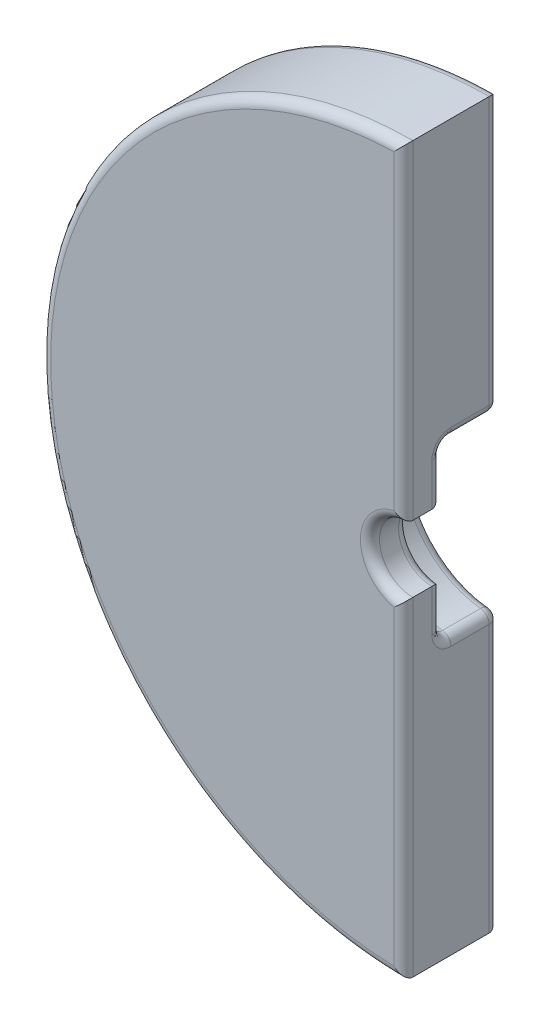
SolidWorks part; units mm, degrees
ref_plane "Спереди" through (0, 0, 0) normal (0, 0, 1) x (1, 0, 0)
ref_plane "Сверху" through (0, 0, 0) normal (0, 1, 0) x (1, 0, 0)
ref_plane "Справа" through (0, 0, 0) normal (1, 0, 0) x (0, 0, -1)
sketch "Эскиз1" plane through (0, 0, 0) normal (0, 0, 1) x (1, 0, 0)
  line L0 (0, 19) -> (0, 1.75)
  line L1 (0, -1.75) -> (0, -19)
  arc A0 (0, 19) -> (0, -19) centre (0, 0) ccw
  arc A1 (0, 1.75) -> (0, -1.75) centre (0, 0) ccw
  dimension "D1" = 38
  dimension "D2" = 3.5
extrude "Бобышка-Вытянуть1" add sketch "Эскиз1" along normal mid plane 5
sketch "Эскиз2" plane through (0, 0, -2.5) normal (0, 0, -1) x (-1, 0, 0)
  circle A0 centre (0, 0) radius 4.5
  dimension "D1" = 9
extrude "Вырез-Вытянуть1" cut sketch "Эскиз2" against normal blind 3
fillet "Скругление1" radius 0.5 14 edges at (0, -4.5, -1) (0, 4.5, -1) (-4.5, 0, 0.5) (0, -3.125, 0.5) (-1.75, 0, 0.5) (0, 3.125, 0.5) (-19, 0, -2.5) (0, -11.75, -2.5) (-4.5, 0, -2.5) (0, 11.75, -2.5) (0, -10.375, 2.5) (-19, 0, 2.5) (0, 10.375, 2.5) (-1.75, 0, 2.5)
